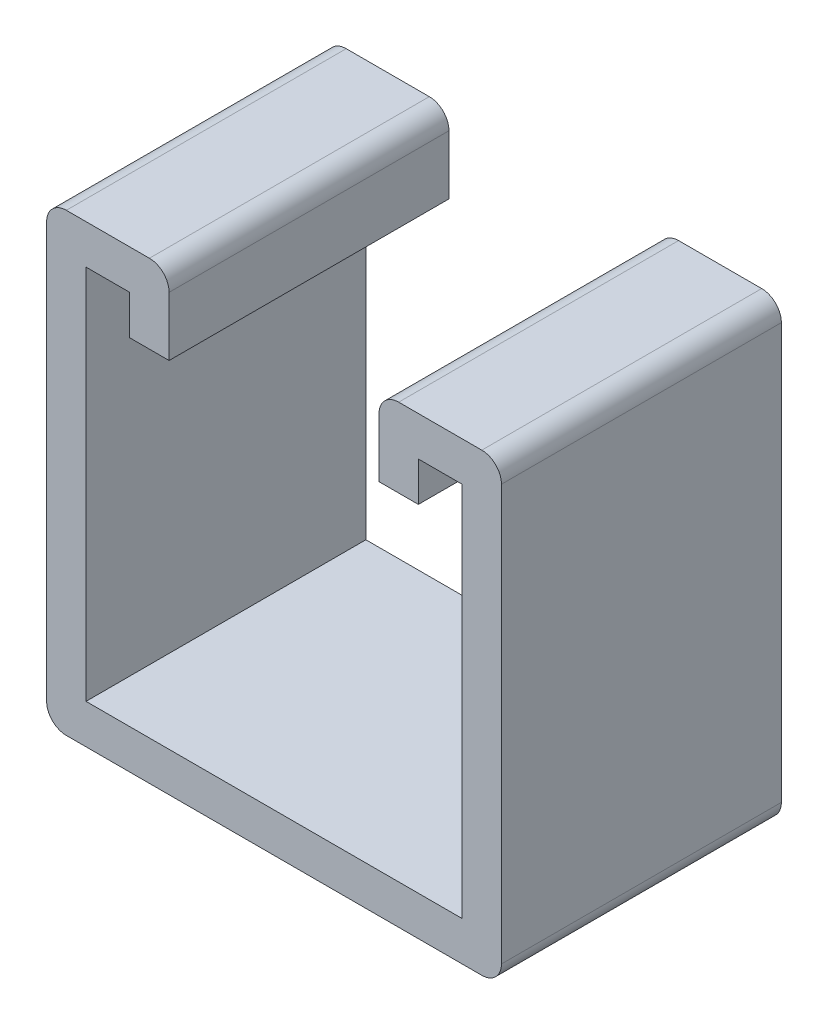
SolidWorks part; units mm, degrees
ref_plane "Plane1" through (0, 0, 0) normal (0, 0, 1) x (1, 0, 0)
ref_plane "Plane2" through (0, 0, 0) normal (0, 1, 0) x (1, 0, 0)
ref_plane "Plane3" through (0, 0, 0) normal (1, 0, 0) x (0, 0, -1)
sketch "Sketch1" plane through (0, 0, 0) normal (0, 0, 1) x (1, 0, 0)
  line L0 (-11.3109, 20.6375) -> (-18.8516, 20.6375)
  line L1 (-20.6375, 18.8516) -> (-20.6375, -18.8516)
  line L2 (-18.8516, -20.6375) -> (18.8516, -20.6375)
  line L3 (20.6375, -18.8516) -> (20.6375, 18.8516)
  line L4 (18.8516, 20.6375) -> (11.3109, 20.6375)
  line L5 (9.525, 18.8516) -> (9.525, 13.4937)
  line L6 (-9.525, 18.8516) -> (-9.525, 13.4938)
  line L7 (-13.0969, 17.0656) -> (-13.0969, 13.4937)
  line L8 (-13.0969, 17.0656) -> (-17.0656, 17.0656)
  line L9 (-17.0656, 17.0656) -> (-17.0656, -17.0656)
  line L10 (-17.0656, -17.0656) -> (17.0656, -17.0656)
  line L11 (17.0656, -17.0656) -> (17.0656, 17.0656)
  line L12 (17.0656, 17.0656) -> (13.0969, 17.0656)
  line L13 (13.0969, 17.0656) -> (13.0969, 13.4937)
  line L14 (-13.0969, 13.4937) -> (-9.525, 13.4938)
  line L15 (9.525, 13.4937) -> (13.0969, 13.4937)
  arc A0 (-11.3109, 20.6375) -> (-9.525, 18.8516) centre (-11.3109, 18.8516) cw
  arc A1 (-20.6375, 18.8516) -> (-18.8516, 20.6375) centre (-18.8516, 18.8516) cw
  arc A2 (-18.8516, -20.6375) -> (-20.6375, -18.8516) centre (-18.8516, -18.8516) cw
  arc A3 (20.6375, -18.8516) -> (18.8516, -20.6375) centre (18.8516, -18.8516) cw
  arc A4 (18.8516, 20.6375) -> (20.6375, 18.8516) centre (18.8516, 18.8516) cw
  arc A5 (9.525, 18.8516) -> (11.3109, 20.6375) centre (11.3109, 18.8516) cw
  dimension "D2" = 1.7859
  dimension "D3" = 20.6375
  dimension "Width" = 41.275
  dimension "D5" = 20.6375
  dimension "Height" = 41.275
  dimension "edge" = 11.1125
  dimension "D8" = 19.05
  dimension "ToeHt" = 7.1437
  dimension "gauge" = 3.5719
extrude "Base-Extrude" add sketch "Sketch1" along normal mid plane 25.4
equation "\"D5@Sketch1\" = \"Height@Sketch1\" / 2"
equation "\"D3@Sketch1\" = \"Width@Sketch1\" / 2"
equation "\"D2@Sketch1\" = \"gauge@Sketch1\" / 2"
equation "\"D8@Sketch1\" = \"Width@Sketch1\" - 2 * \"edge@Sketch1\""
equation "\"gauge@Sketch1\" = \"ToeHt@Sketch1\" / 2"
